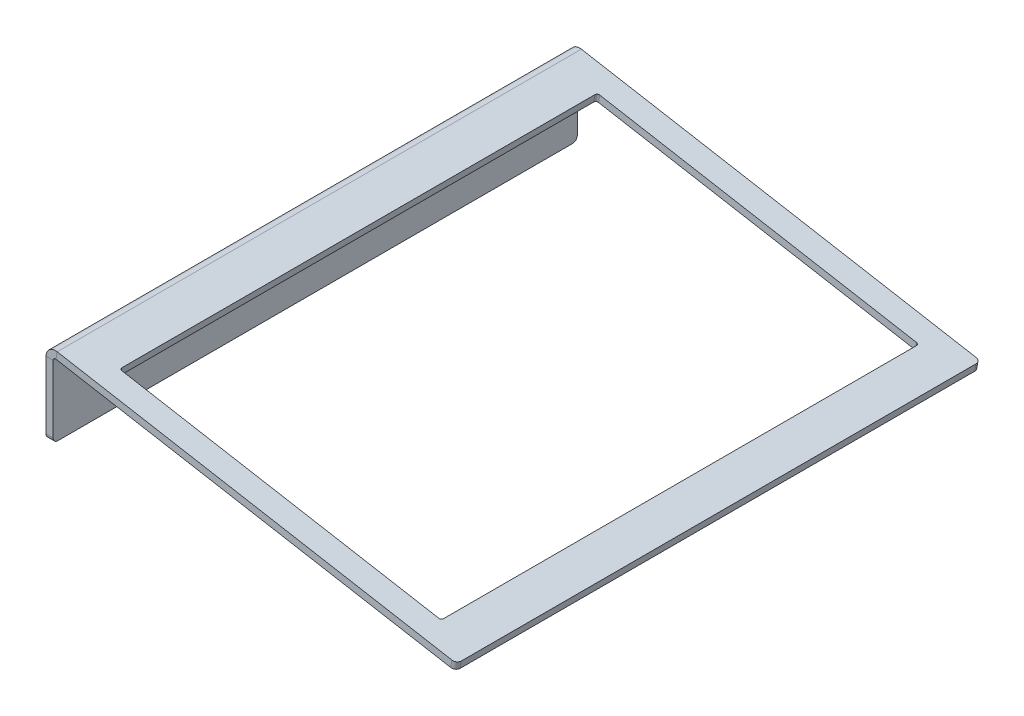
SolidWorks part; units mm, degrees
ref_plane "Plan1" through (0, 0, 0) normal (0, 0, 1) x (1, 0, 0)
ref_plane "Plan2" through (0, 0, 0) normal (0, 1, 0) x (1, 0, 0)
ref_plane "Plan3" through (0, 0, 0) normal (1, 0, 0) x (0, 0, -1)
sketch "Esquisse1" plane through (0, 0, 0) normal (0, 0, 1) x (1, 0, 0)
  line L0 (0, 0) -> (172.3414, -30.3884)
  line L6 (0, 0) -> (0, -35)
  dimension "D1" = 35
  dimension "D2" = 80
  dimension "D3" = 175
extrude "Base-Extru.-Mince" add sketch "Esquisse1" along normal mid plane 220 thin
sketch "Esquisse2" plane through (0, 0, 0) normal (0.1736, 0.9848, 0) x (-0.9848, 0.1736, 0)
  line L0 (-165.6303, 0) -> (14.7324, 0) construction
  line L1 (-157.5, 100.25) -> (-22.5, 100.25)
  line L2 (-158.5, 99.25) -> (-158.5, -99.25)
  line L3 (-157.5, -100.25) -> (-22.5, -100.25)
  line L4 (-21.5, 99.25) -> (-21.5, -99.25)
  line L5 (-175, 110) -> (-175, -110) construction
  line L6 (-90, 81.4569) -> (-90, -76.384) construction
  arc A0 (-21.5, 99.25) -> (-22.5, 100.25) centre (-22.5, 99.25) ccw
  arc A1 (-158.5, 99.25) -> (-157.5, 100.25) centre (-157.5, 99.25) cw
  arc A2 (-157.5, -100.25) -> (-158.5, -99.25) centre (-157.5, -99.25) cw
  arc A3 (-21.5, -99.25) -> (-22.5, -100.25) centre (-22.5, -99.25) cw
  point P11 (-21.5, 100.25)
  point P14 (-158.5, 100.25)
  point P17 (-158.5, -100.25)
  dimension "D4" = 1
  dimension "D1" = 200.5
  dimension "D2" = 137
  dimension "D3" = 16.5
extrude "Enlèv. mat.-Extru.1" cut sketch "Esquisse2" against normal up to next
sketch "Esquisse3"
  line L0 (0, -50.9292) -> (0, 13.5344) construction
  line L1 (-110, -35) -> (110, -35) construction
  circle A0 centre (-90, -20) radius 3.5
  circle A1 centre (90, -20) radius 3.5
fillet "Congé1" radius 2
bend "Pli dans angle1" parameters "D1"=0
flatten bends "Dépliage 1" parameters "D1"=0
sketch "Esquisse-Angle1" plane through (0, 0, 0) normal (-1, 0, 0) x (0, 0, 1)
  line L0 (-110, -3.017) -> (110, -3.017) construction
sheet metal parameters "Tôlerie 1" parameters "D1"=1, "Epaisseur"=2, "D4"=100, "D5"=1
extrude "Enlèv. mat.-Extru.2" cut sketch "Esquisse3" against normal through all
process bends "Pliage 1" parameters "D1"=0
sketch "Esquisse-Plate1" plane through (0, 0, 0) normal (-1, 0, 0) x (0, 0, 1)
